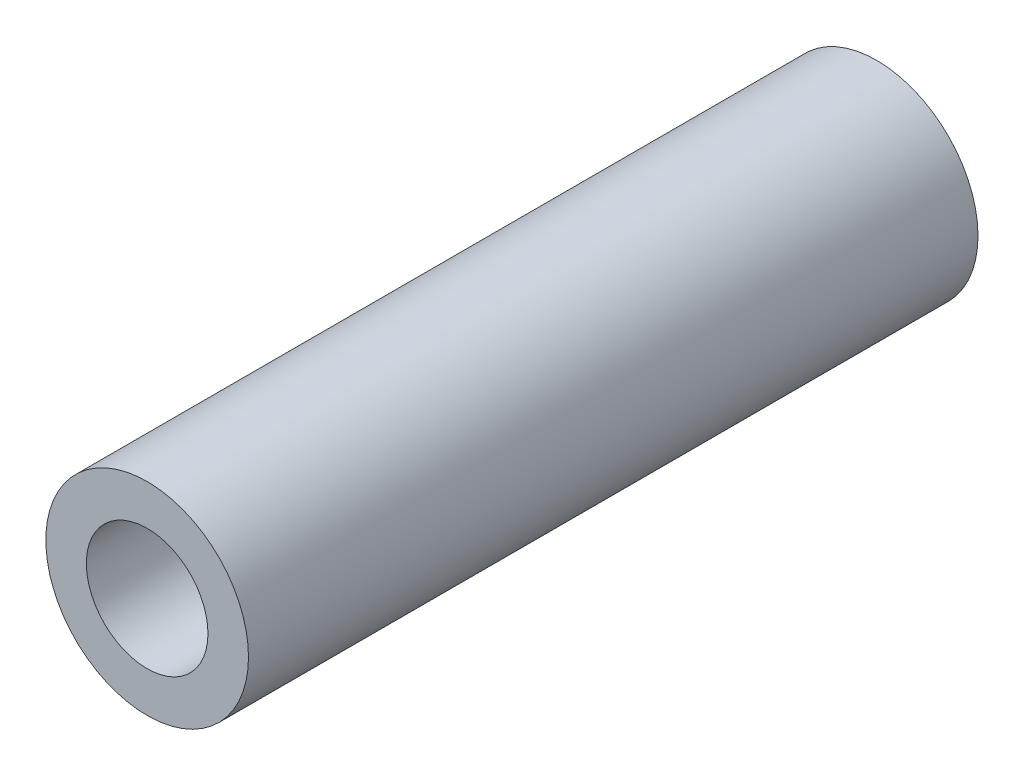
SolidWorks part; units mm, degrees
ref_plane "Plan de face" through (0, 0, 0) normal (0, 0, 1) x (1, 0, 0)
ref_plane "Plan de dessus" through (0, 0, 0) normal (0, 1, 0) x (1, 0, 0)
ref_plane "Plan de droite" through (0, 0, 0) normal (1, 0, 0) x (0, 0, -1)
sketch "Esquisse1" plane through (0, 0, 0) normal (0, 0, 1) x (1, 0, 0)
  circle A0 centre (0, 0) radius 15
  circle A1 centre (0, 0) radius 9
  dimension "D1" = 30
  dimension "D2" = 18
extrude "Extrusion1" add sketch "Esquisse1" along normal blind 108
